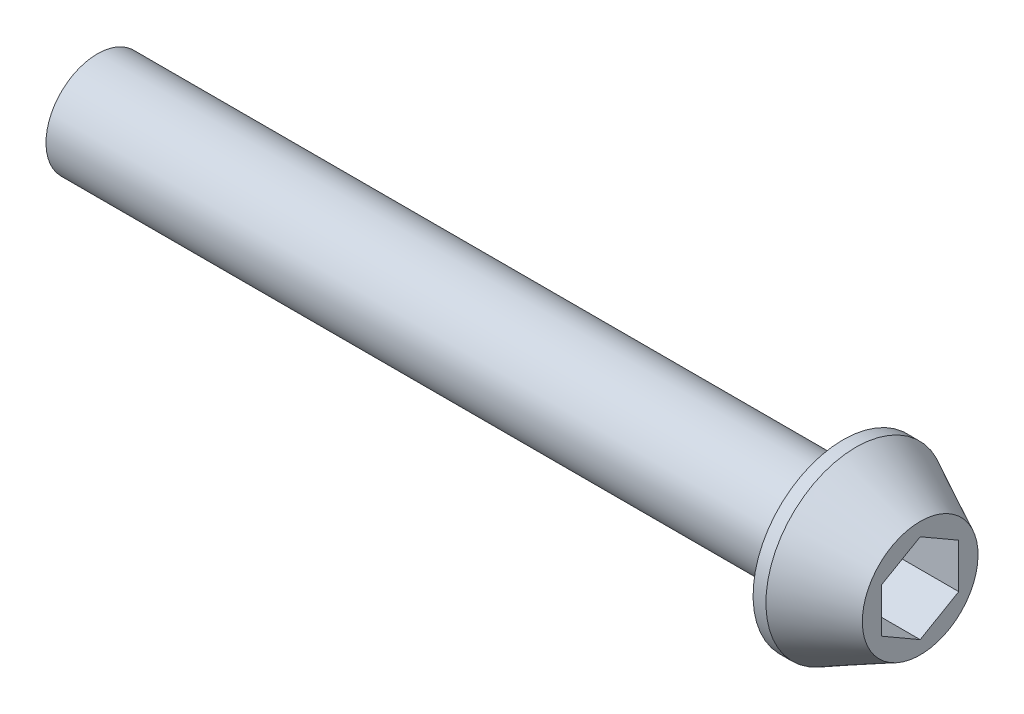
SolidWorks part; units mm, degrees
ref_plane "Alzado" through (0, 0, 0) normal (0, 0, 1) x (1, 0, 0)
ref_plane "Planta" through (0, 0, 0) normal (0, 1, 0) x (1, 0, 0)
ref_plane "Vista lateral" through (0, 0, 0) normal (1, 0, 0) x (0, 0, -1)
sketch "Croquis1" plane through (0, 0, 0) normal (0, 0, 1) x (1, 0, 0)
  line L0 (0, 0) -> (-64, 0) construction
  line L2 (0, 4.5) -> (0, 0)
  line L4 (-64, 4) -> (-64, 3)
  line L5 (-64, 0) -> (-64, 3) construction
  line L7 (-64, 4) -> (-6, 4)
  line L8 (-6, 4) -> (-6, 7)
  line L9 (-6, 7) -> (-5, 7)
  line L10 (-5, 7) -> (0, 4.5)
  line L11 (-64, 3) -> (-6, 3)
  line L12 (-6, 3) -> (-6, 0)
  line L13 (-6, 0) -> (0, 0)
  dimension "D1" = 64
  dimension "D2" = 1
  dimension "D3" = 4
  dimension "D4" = 7
  dimension "D5" = 6
  dimension "D6" = 1
  dimension "D7" = 4.5
revolve "Revolución1" add sketch "Croquis1" angle 360 about L0
sketch "Croquis2" plane through (0, 0, 0) normal (1, 0, 0) x (0, 0, -1)
  line L1 (0, 3.4641) -> (-3, 1.7321)
  line L2 (-3, 1.7321) -> (-3, -1.7321)
  line L3 (-3, -1.7321) -> (0, -3.4641)
  line L4 (0, -3.4641) -> (3, -1.7321)
  line L5 (3, -1.7321) -> (3, 1.7321)
  line L6 (3, 1.7321) -> (0, 3.4641)
  circle A0 centre (0, 0) radius 3 construction
  dimension "D1" = 6
extrude "Cortar-Extruir1" cut sketch "Croquis2" against normal blind 5
